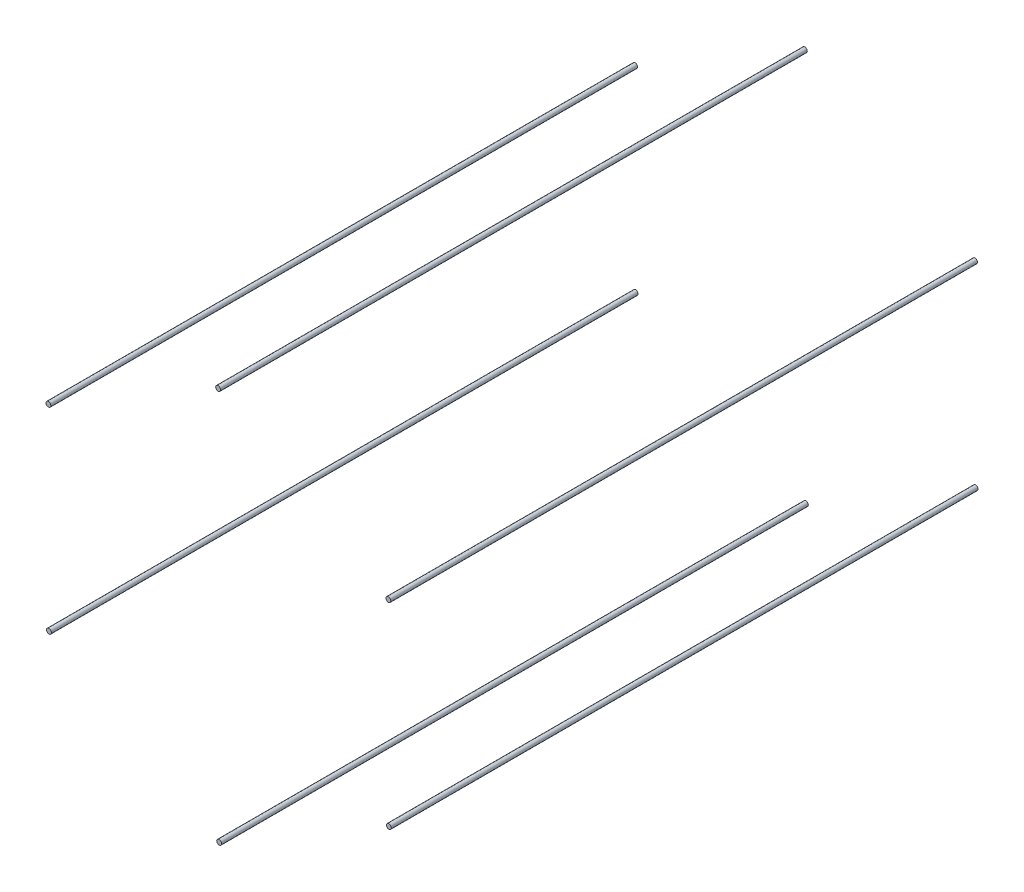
SolidWorks part; units mm, degrees
ref_plane "Front Plane" through (0, 0, 0) normal (1, 0, 0) x (0, 1, 0)
ref_plane "Top Plane" through (0, 0, 0) normal (0, 0, 1) x (0, 1, 0)
ref_plane "Right Plane" through (0, 0, 0) normal (0, 1, 0) x (-1, 0, 0)
sketch "Hex 6in Beam" plane through (0, 0, 0) normal (0, 0, 1) x (0, 1, 0)
  line L1 (115.4305, -199.9315) -> (230.8611, 0)
  line L2 (230.8611, 0) -> (115.4305, 199.9315)
  line L3 (115.4305, 199.9315) -> (-115.4305, 199.9315)
  line L4 (-115.4305, 199.9315) -> (-230.8611, 0)
  line L5 (-230.8611, 0) -> (-115.4305, -199.9315)
  line L6 (-115.4305, -199.9315) -> (115.4305, -199.9315)
  circle A0 centre (0, 0) radius 199.9315 construction
  line B0 (76.2, 76.2) -> (215.5261, 215.5261) construction
  line B1 (-76.2, 76.2) -> (76.2, 76.2) construction
  line B2 (-76.2, 76.2) -> (-76.2, -76.2) construction
  line B3 (-76.2, -76.2) -> (76.2, -76.2) construction
  line B4 (76.2, 76.2) -> (76.2, -76.2) construction
  line B5 (-76.2, 76.2) -> (76.2, -76.2) construction
  line B6 (-76.2, -76.2) -> (76.2, 76.2) construction
  line B7 (238.1934, 0) -> (119.0967, 206.2815)
  line B8 (119.0967, 206.2815) -> (-119.0967, 206.2815)
  line B9 (-119.0967, 206.2815) -> (-238.1934, 0)
  line B10 (-238.1934, 0) -> (-119.0967, -206.2815)
  line B11 (-119.0967, -206.2815) -> (119.0967, -206.2815)
  line B12 (119.0967, -206.2815) -> (238.1934, 0)
  circle B13 centre (0, 0) radius 206.2815 construction
  dimension "D1" = 6.35
sketch_block_instance "Blk 6in Hex-1"
sketch_block "Blk 6in Hex" parameters "D1"=152.4, "D2"=152.4
sketch "Sketch2" plane through (0, 0, 0) normal (0, 0, 1) x (0, 1, 0)
  line L0 (230.8611, 0) -> (115.4305, 199.9315) construction
  circle A0 centre (223.5287, 0) radius 6.35
  circle A1 centre (111.7644, -193.5815) radius 6.35
  circle A2 centre (-111.7644, -193.5815) radius 6.35
  circle A3 centre (-223.5287, 0) radius 6.35
  circle A4 centre (-111.7644, 193.5815) radius 6.35
  circle A5 centre (111.7644, 193.5815) radius 6.35
  point P17 (0, 0)
  dimension "D1" = 12.7
  dimension "D2" = 6
extrude "Boss-Extrude1" [suppressed] add sketch "Sketch2" along normal mid plane 1536.7
sketch "Sketch3" plane through (0, 0, 0) normal (0, 0, 1) x (0, 1, 0)
  line L0 (520.5967, 0) -> (260.2984, 450.85)
  line L1 (527.9291, 0) -> (263.9645, 457.2)
  line L2 (263.9645, 457.2) -> (-263.9645, 457.2)
  line L3 (-263.9645, 457.2) -> (-527.9291, 0)
  line L4 (-527.9291, 0) -> (-263.9645, -457.2)
  line L5 (-263.9645, -457.2) -> (263.9645, -457.2)
  line L6 (263.9645, -457.2) -> (527.9291, 0)
  line L7 (260.2984, 450.85) -> (-260.2984, 450.85)
  line L8 (-260.2984, 450.85) -> (-520.5967, 0)
  line L9 (-520.5967, 0) -> (-260.2984, -450.85)
  line L10 (-260.2984, -450.85) -> (260.2984, -450.85)
  line L11 (260.2984, -450.85) -> (520.5967, 0)
  circle A0 centre (0, 0) radius 457.2 construction
  dimension "D1" = 914.4
  dimension "D2" = 6.35
sketch "Sketch4" plane through (0, 0, 0) normal (0, 0, 1) x (0, 1, 0)
  line L6 (260.2984, -450.85) -> (520.5967, 0) construction
  line L7 (520.5967, 0) -> (260.2984, 450.85) construction
  circle A0 centre (513.2644, 0) radius 6.35
  circle A1 centre (257.4116, -445.85) radius 6.35
  circle A2 centre (-256.6322, -447.2) radius 6.35
  circle A3 centre (-514.8232, -2.7) radius 6.35
  circle A4 centre (-258.9705, 443.15) radius 6.35
  circle A5 centre (255.0733, 444.5) radius 6.35
  point P18 (-0.7794, -1.35)
  dimension "D1" = 12.7
  dimension "D2" = 6
extrude "Boss-Extrude2" add sketch "Sketch4" along normal mid plane 1536.7
